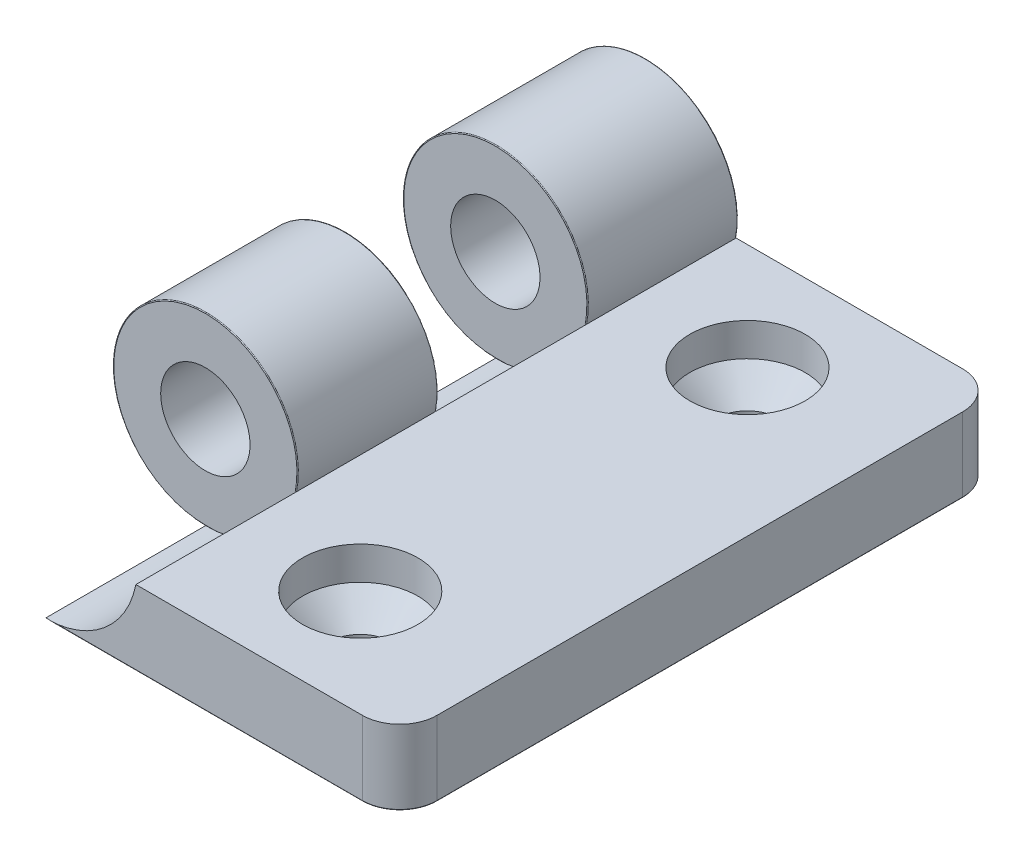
SolidWorks part; units mm, degrees
ref_plane "Front Plane" through (0, 0, 0) normal (0, 0, 1) x (1, 0, 0)
ref_plane "Top Plane" through (0, 0, 0) normal (0, 1, 0) x (1, 0, 0)
ref_plane "Right Plane" through (0, 0, 0) normal (1, 0, 0) x (0, 0, -1)
sketch "Sketch1" plane through (0, 0, 0) normal (0, 0, 1) x (1, 0, 0)
  circle A0 centre (0, 0) radius 6.2
extrude "Boss-Extrude1" add sketch "Sketch1" along normal blind 40.3
sketch "Sketch2" plane through (0, 0, 0) normal (0, 0, 1) x (1, 0, 0)
  circle A0 centre (0, 0) radius 3
extrude "Cut-Extrude1" cut sketch "Sketch2" along normal through all
sketch "Sketch3" plane through (0, 0, 0) normal (0, 0, 1) x (1, 0, 0)
  line L1 (0, -6.2) -> (23.8, -6.2)
  line L2 (0, -6.2) -> (0, -1.2)
  line L3 (0, -1.2) -> (23.8, -1.2)
  line L4 (23.8, -6.2) -> (23.8, -1.2)
  circle A0 centre (0, 0) radius 6.2 construction
extrude "Boss-Extrude2" add sketch "Sketch3" along normal blind 40.3
sketch "Sketch4" plane through (0, 0, 0) normal (0, 0, 1) x (1, 0, 0)
  circle A0 centre (0, 0) radius 3
extrude "Cut-Extrude2" cut sketch "Sketch4" along normal blind 40.3
ref_plane "Plane1" through (0, -1.2, 0) normal (0, 1, 0) x (1, 0, 0)
sketch "Sketch5" plane through (0, -1.2, 0) normal (0, 1, 0) x (1, 0, 0)
  line L1 (23.8, 0) -> (14, 0) construction
  line L2 (23.8, 0) -> (23.8, -7.15) construction
  line L3 (23.8, -7.15) -> (14, -7.15) construction
  line L4 (14, 0) -> (14, -7.15) construction
  line L5 (23.8, -40.3) -> (14, -40.3) construction
  line L6 (23.8, -40.3) -> (23.8, -33.15) construction
  line L7 (23.8, -33.15) -> (14, -33.15) construction
  line L8 (14, -40.3) -> (14, -33.15) construction
  circle A0 centre (14, -7.15) radius 3.875
  circle A1 centre (14, -33.15) radius 3.875
extrude "Cut-Extrude3" cut sketch "Sketch5" against normal blind 2 contours A0
sketch "Sketch6" plane through (0, -1.2, 0) normal (0, 1, 0) x (1, 0, 0)
  line L1 (23.8, -40.3) -> (14, -40.3) construction
  line L2 (23.8, -40.3) -> (23.8, -33.15) construction
  line L3 (23.8, -33.15) -> (14, -33.15) construction
  line L4 (14, -40.3) -> (14, -33.15) construction
  circle A0 centre (14, -33.15) radius 3.875
extrude "Cut-Extrude4" cut sketch "Sketch6" against normal blind 2
sketch "Sketch7" plane through (0, -1.2, 0) normal (0, 1, 0) x (1, 0, 0)
  circle A0 centre (14, -33.15) radius 2.1
extrude "Cut-Extrude5" cut sketch "Sketch7" against normal through all
sketch "Sketch8" plane through (0, -1.2, 0) normal (0, 1, 0) x (1, 0, 0)
  circle A0 centre (14, -7.15) radius 2.1
extrude "Cut-Extrude6" cut sketch "Sketch8" against normal through all
chamfer "Chamfer1" distance 2 angle 45 1 edges at (14, -3.2, 35.25)
chamfer "Chamfer2" distance 2 angle 45 1 edges at (14, -3.2, 9.25)
fillet "Fillet1" radius 2.5 1 edges at (23.8, -3.7, 40.3)
fillet "Fillet2" radius 2.5 1 edges at (23.8, -3.7, 0)
sketch "Sketch11" plane through (0, 0, 0) normal (1, 0, 0) x (0, 0, -1)
  line L0 (0, 0) -> (-10.075, 0) construction
  line L1 (-10.075, 0) -> (-20.15, 0)
  line L2 (-20.15, 0) -> (-30.225, 0)
  line L3 (-30.225, 0) -> (-40.3, 0)
  dimension "D1" = 10.075
ref_plane "Plane2" through (0, 0, 40.3) normal (0, 0, -1) x (-1, 0, 0)
sketch "Sketch12" plane through (0, 0, 40.3) normal (0, 0, -1) x (-1, 0, 0)
  circle A0 centre (0, 0) radius 6.2
extrude "Cut-Extrude7" cut sketch "Sketch12" along normal blind 10.75
sketch "Sketch13" plane through (0, 0, 0) normal (1, 0, 0) x (0, 0, -1)
  line L0 (0, 0) -> (-20.15, 0) construction
ref_plane "Plane3" through (0, 0, 20.15) normal (0, 0, -1) x (-1, 0, 0)
sketch "Sketch14" plane through (0, 0, 20.15) normal (0, 0, -1) x (-1, 0, 0)
  circle A0 centre (0, 0) radius 6.2
extrude "Cut-Extrude8" cut sketch "Sketch14" along normal blind 10.07
fillet "Fillet3" radius 0.05 1 edges at (-3.937, 4.7896, 29.55)
fillet "Fillet4" radius 0.05 1 edges at (-3.937, 4.7896, 20.15)
fillet "Fillet5" radius 0.05 1 edges at (-3.937, 4.7896, 10.08)
fillet "Fillet6" radius 0.05 6 edges at (10.65, -6.2, 40.3) (23.0678, -6.2, 39.5678) (23.8, -6.2, 20.15) (23.0678, -6.2, 0.7322) (10.65, -6.2, 0) (-3.937, 4.7896, 0)
